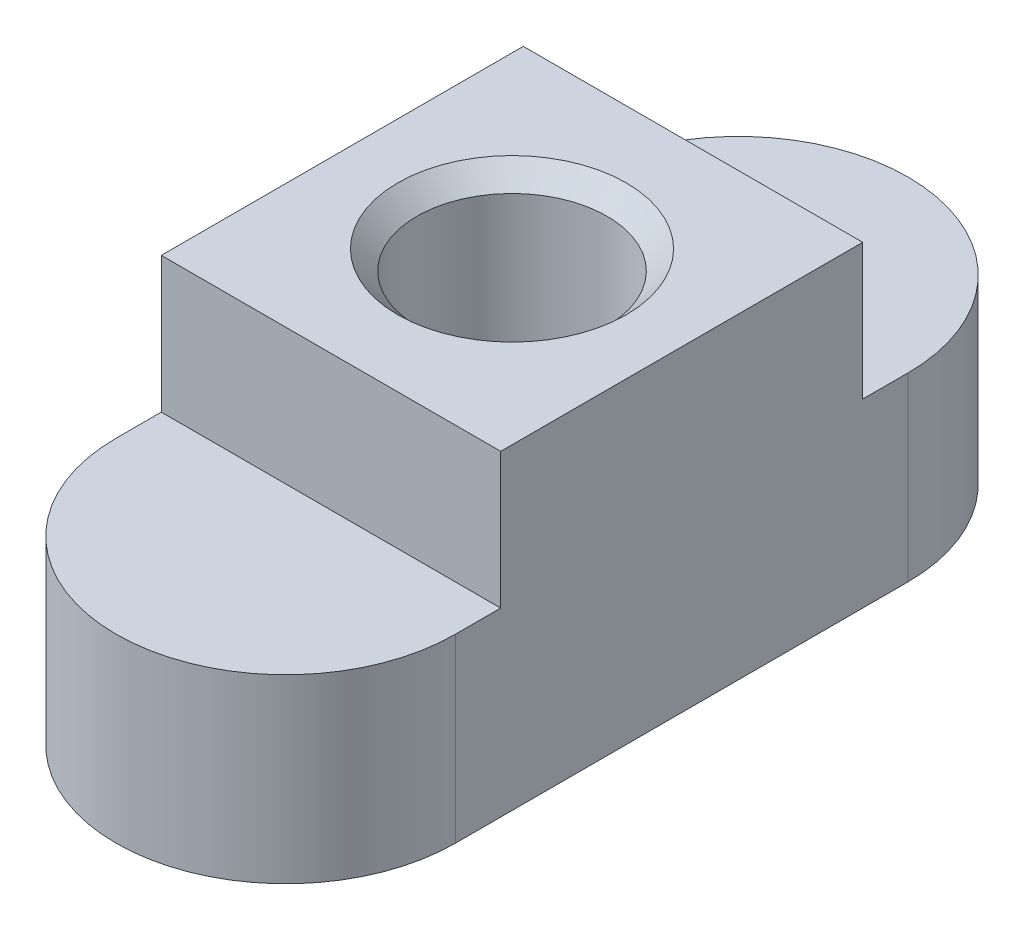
SolidWorks part; units mm, degrees
ref_plane "Ebene vorne" through (0, 0, 0) normal (0, 0, 1) x (1, 0, 0)
ref_plane "Ebene oben" through (0, 0, 0) normal (0, 1, 0) x (1, 0, 0)
ref_plane "Ebene rechts" through (0, 0, 0) normal (1, 0, 0) x (0, 0, -1)
sketch "Skizze1" plane through (0, 0, 0) normal (0, 1, 0) x (1, 0, 0)
  line L0 (0, -5) -> (0, 5) construction
  line L1 (0, -53.599) -> (0, 53.599) construction
  line L2 (-3.75, -5) -> (-3.75, 5)
  line L3 (3.75, -5) -> (3.75, 5)
  arc A0 (-3.75, -5) -> (3.75, -5) centre (0, -5) ccw
  arc A1 (3.75, 5) -> (-3.75, 5) centre (0, 5) ccw
  point P5 (0, 0)
  dimension "D1" = 7.5
  dimension "D2" = 10
extrude "Aufsatz-Linear austragen1" add sketch "Skizze1" along normal blind 4
sketch "Skizze2" plane through (0, 4, 0) normal (0, 1, 0) x (1, 0, 0)
  line L0 (3.75, -5) -> (3.75, 5) construction
  line L1 (-3.75, -4) -> (3.75, -4)
  line L2 (-3.75, -4) -> (-3.75, 4)
  line L3 (-3.75, 4) -> (3.75, 4)
  line L4 (3.75, -4) -> (3.75, 4)
  line L5 (-3.75, -4) -> (3.75, 4) construction
  line L6 (-3.75, 4) -> (3.75, -4) construction
  point P0 (0, 0)
  dimension "D1" = 8
extrude "Aufsatz-Linear austragen2" add sketch "Skizze2" along normal blind 3
hole_wizard "M5 Gewindebohrung1" positions "Skizze3" profile "Skizze4" tap size "M5" standard "DIN"
sketch "Skizze3" plane through (0, 7, 0) normal (0, 1, 0) x (1, 0, 0)
  point P0 (0, 0)
sketch "Skizze4" plane through (0, 7, 0) normal (1, 0, 0) x (0, 0, 1)
  line L0 (0, 0) -> (0, 7)
  line L1 (0, 7) -> (2.1, 7)
  line L2 (2.1, 7) -> (2.1, 0.425)
  line L3 (2.1, 0.425) -> (2.525, 0)
  line L5 (2.525, 0) -> (0, 0)
  line L6 (-2.1, 0.425) -> (-2.525, 0) construction
  line L11 (0, -6.35) -> (0, 107.95) construction
  dimension "Bohrerdurchmesser" = 4.2
  dimension "Bohrungstiefe" = 7
  dimension "Senkdurchmesser (Oben)" = 5.05
  dimension "Senkwinkel (Oben)" = 90
